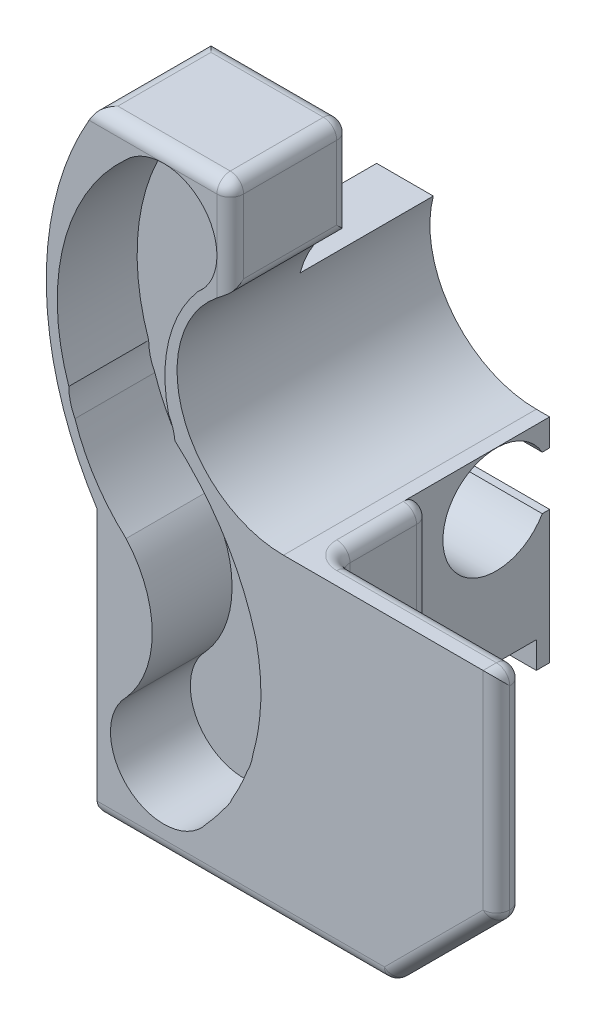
SolidWorks part; units mm, degrees
ref_plane "Plan1" through (0, 0, 0) normal (0, 0, 1) x (1, 0, 0)
ref_plane "Plan2" through (0, 0, 0) normal (0, 1, 0) x (1, 0, 0)
ref_plane "Plan3" through (0, 0, 0) normal (1, 0, 0) x (0, 0, -1)
sketch "Esquisse1" plane through (0, 0, 0) normal (0, 0, 1) x (1, 0, 0)
  line L0 (19, -40) -> (19, -50)
  line L1 (19, -50) -> (30, -50)
  line L2 (30, -50) -> (34, -46)
  line L3 (34, -46) -> (34, -38)
  line L4 (34, -38) -> (26, -38)
  line L5 (24, 60) -> (24, -33) construction
  line L6 (40, -27) -> (10, -27) construction
  line L7 (24, -30.5365) -> (24, -27)
  line L8 (24, -27) -> (19, -27)
  circle A0 centre (26.001, -34) radius 4 construction
  arc A1 (26, -38) -> (24, -30.5365) centre (26.001, -34) cw
  arc A2 (19, -40) -> (19, -27) centre (29.0871, -33.5) cw
  dimension "D7" = 8
  dimension "D13" = 12
  dimension "D1" = 10
  dimension "D2" = 11
  dimension "D3" = 4
  dimension "D4" = 4
  dimension "D5" = 8
  dimension "D6" = 8
  dimension "D8" = 0.001
  dimension "D9" = 10
  dimension "D10" = 5
  dimension "D11" = 23
  dimension "D12" = 5
extrude "Base-Extrusion" add sketch "Esquisse1" along normal blind 9.5
sketch "Esquisse2" plane through (0, 0, 0) normal (0, 0, -1) x (-1, 0, 0)
  line L0 (-26.001, -25.7076) -> (-26.001, -33)
  line L1 (-26.001, -25.7076) -> (-16.2129, -25.7076)
  line L2 (-26.001, -33) -> (-20, -33)
  line L3 (-20, -33) -> (-20, -46)
  line L4 (-20, -46) -> (-26.5, -46)
  line L5 (-26.5, -46) -> (-26.5, -35.8028)
  line L6 (-26.5, -35.8028) -> (-36.7909, -35.8028)
  line L7 (-36.7909, -35.8028) -> (-36.7909, -53.8028)
  line L8 (-36.7909, -53.8028) -> (-16.2129, -53.8028)
  line L9 (-16.2129, -25.7076) -> (-16.2129, -53.8028)
  line L10 (-19, -40) -> (-19, -50) construction
  line L11 (-19, -50) -> (-30, -50) construction
  dimension "D1" = 6.5
  dimension "D2" = 1
  dimension "D3" = 4
  dimension "D4" = 13
  dimension "D5" = 18
extrude "Enlèv. mat.-Extru.1" cut sketch "Esquisse2" against normal blind 5
sketch "Esquisse3" plane through (0, -46, 0) normal (0, -1, 0) x (1, 0, 0)
  line L0 (20, 0.5) -> (30, 0.5)
  line L2 (20, 0.5) -> (16.9305, 5)
  line L4 (16.9305, 5) -> (29.7457, 5)
  line L5 (29.7457, 5) -> (30, 0.5)
  line L7 (19, 5) -> (30, 5) construction
  dimension "D1" = 4.5
  dimension "D2" = 4.5
extrude "Enlèv. mat.-Extru.2" cut sketch "Esquisse3" against normal blind 1
sketch "Esquisse4" plane through (26.5, 0, 0) normal (1, 0, 0) x (0, 0, -1)
  line L2 (0, -46) -> (0, -38) construction
  line L3 (-5, -38) -> (0, -38) construction
  circle A0 centre (-2.01, -40.01) radius 2
  dimension "D1" = 4
  dimension "D2" = 2.01
  dimension "D3" = 2.01
extrude "Enlèv. mat.-Extru.4" cut sketch "Esquisse4" against normal through all
sketch "Esquisse5" plane through (0, 0, 0) normal (0, 0, -1) x (-1, 0, 0)
  line L0 (-20, -40.01) -> (-26.5, -40.01) construction
  line L1 (-20, -39.01) -> (-30.9955, -39.01)
  line L2 (-20, -39.01) -> (-20, -41.01)
  line L3 (-20, -41.01) -> (-30.9955, -41.01)
  line L4 (-30.9955, -39.01) -> (-30.9955, -41.01)
  dimension "D1" = 2
  dimension "D2" = 1
extrude "Enlèv. mat.-Extru.5" cut sketch "Esquisse5" against normal blind 1
sketch "Esquisse6" plane through (0, 0, 5) normal (0, 0, -1) x (-1, 0, 0)
  line L0 (-34, -38) -> (-34, -46)
  line L1 (-34, -46) -> (-30, -50)
  line L2 (-30, -50) -> (-27, -50)
  line L4 (-27, -50) -> (-27, -38)
  line L5 (-27, -38) -> (-34, -38)
extrude "Enlèv. mat.-Extru.6" cut sketch "Esquisse6" against normal blind 3.5
fillet "Congé3" radius 0.5
fillet "Congé4" radius 0.5
fillet "Congé5" radius 0.5
sketch "Esquisse7" plane through (0, 0, 9.5) normal (0, 0, 1) x (1, 0, 0)
  line L0 (24, -30.5365) -> (24, -27.5) construction
  line L1 (19.2764, -27) -> (23.5, -27) construction
  line L2 (27.5, -50) -> (19.5, -50) construction
  line L3 (19, -40) -> (19, -49.5) construction
  line L4 (29.0871, -33.5) -> (19.7582, -28.5171) construction
  circle A0 centre (21.5, -29.5) radius 2 construction
  circle A1 centre (21.5, -47) radius 2 construction
  circle A2 centre (21.5, -39) radius 2
  arc A3 (21.5, -39) -> (21.5, -29.5) centre (26.25, -34.25) cw construction
  arc A4 (21.5, -47) -> (21.5, -39) centre (17.5, -43) ccw construction
  circle A5 centre (19.5398, -33.9359) radius 2
  circle A6 centre (21.5, -29.5) radius 2
  circle A7 centre (21.5, -47) radius 2
  circle A8 centre (23.1569, -43) radius 2
  dimension "D1" = 4
  dimension "D4" = 4
  dimension "D7" = 8
  dimension "D10" = 4
  dimension "D8" = 4
  dimension "D11" = 4
  dimension "D2" = 2.5
  dimension "D3" = 2.5
  dimension "D5" = 3
  dimension "D6" = 2.5
  dimension "D9" = 2.5
extrude "Enlèv. mat.-Extru.7" cut sketch "Esquisse7" against normal blind 3
sketch "Esquisse8" plane through (0, 0, 9.5) normal (0, 0, 1) x (1, 0, 0)
  arc A0 (21.5, -47) -> (21.5, -39) centre (17.5, -43) ccw construction
  arc A1 (21.5, -39) -> (21.5, -29.5) centre (26.25, -34.25) cw construction
  circle A2 centre (20.3258, -31.0831) radius 2
  circle A3 centre (19.9348, -36.5398) radius 2
  circle A4 centre (22.5977, -40.5477) radius 2
  circle A5 centre (22.8716, -44.7738) radius 2
  dimension "D1" = 4
  dimension "D2" = 4
  dimension "D3" = 4
  dimension "D4" = 4
extrude "Enlèv. mat.-Extru.8" cut sketch "Esquisse8" against normal blind 3
sketch "Esquisse9" plane through (0, 0, 9.5) normal (0, 0, 1) x (1, 0, 0)
  arc A0 (21.5, -47) -> (21.5, -38.9667) centre (17.4834, -42.9834) ccw construction
  arc A1 (21.5, -38.9667) -> (21.5, -29.3691) centre (26.2988, -34.1679) cw construction
  circle A2 centre (22.2513, -46.0711) radius 2
  circle A3 centre (23.0291, -41.754) radius 2
  circle A4 centre (20.5507, -37.7757) radius 2
  circle A5 centre (19.8338, -32.1036) radius 2
  dimension "D1" = 4
  dimension "D2" = 8.5364
  dimension "D3" = 4
  dimension "D4" = 4
  dimension "D5" = 4
extrude "Enlèv. mat.-Extru.9" cut sketch "Esquisse9" against normal blind 3
sketch "Esquisse10" plane through (0, 0, 9.5) normal (0, 0, 1) x (1, 0, 0)
  line L0 (23.1122, -48.1835) -> (20.0861, -45.5855)
  line L1 (23.1122, -30.6835) -> (20.0861, -28.0855)
  arc A0 (23.1122, -48.1835) -> (24.9825, -41.3247) centre (17.3481, -42.9273) ccw
  arc A1 (20.3915, -45.3353) -> (23.3597, -47.7358) centre (21.5, -47) ccw construction
  arc A2 (24.9825, -42.1833) -> (24.5974, -40.5128) centre (23.0291, -41.754) ccw construction
  arc A3 (20.0861, -45.5855) -> (20.0861, -40.4145) centre (17.1763, -43) ccw
  arc A4 (19.5682, -39.5177) -> (20.6127, -40.7924) centre (21.5, -39) ccw construction
  arc A5 (20.0861, -40.4145) -> (17.9348, -36.5398) centre (24.5698, -35.3905) cw
  arc A6 (18.249, -35.4636) -> (18.5627, -37.9949) centre (19.9348, -36.5398) ccw construction
  arc A7 (17.9348, -36.5398) -> (20.0861, -28.0855) centre (25.4417, -33.9491) cw
  arc A8 (21.5, -27.5) -> (19.5151, -29.2548) centre (21.5, -29.5) ccw construction
  arc A9 (23.1122, -30.6835) -> (21.9227, -36.3205) centre (26.6946, -34.3835) ccw
  arc A10 (22.3107, -31.3283) -> (21.5, -27.5) centre (21.5, -29.5) ccw construction
  arc A11 (21.9227, -36.3205) -> (24.9825, -41.3247) centre (15.3082, -43.8025) cw
extrude "Enlèv. mat.-Extru.10" cut sketch "Esquisse10" against normal blind 3
fillet "Congé7" radius 0.5
fillet "Congé8" radius 0.5
fillet "Congé10" radius 0.5
sketch "Esquisse12" plane through (0, 0, 9.5) normal (0, 0, 1) x (1, 0, 0)
  line L0 (21.5, -29.4448) -> (21.5, -47.1147) construction
